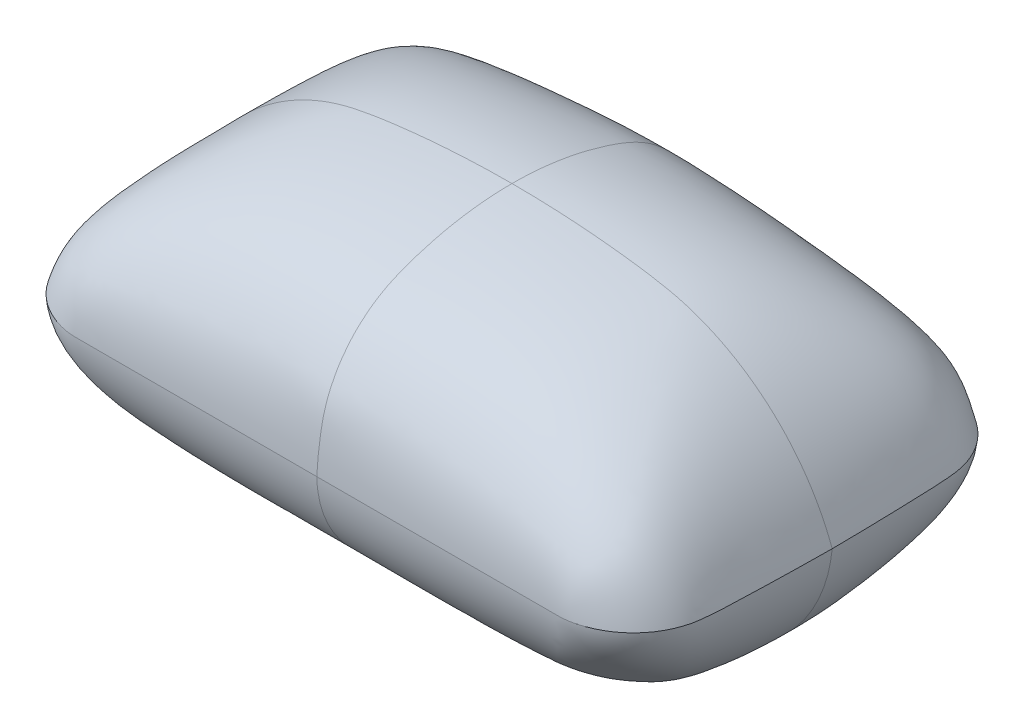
SolidWorks part; units mm, degrees
ref_plane "Front Plane" through (0, 0, 0) normal (0, 0, 1) x (1, 0, 0)
ref_plane "Top Plane" through (0, 0, 0) normal (0, 1, 0) x (1, 0, 0)
ref_plane "Right Plane" through (0, 0, 0) normal (1, 0, 0) x (0, 0, -1)
sketch "Top Layout Sketch" plane through (0, 0, 0) normal (0, 1, 0) x (1, 0, 0)
  line L0 (0, 25) -> (30.5308, 25)
  line L1 (0, -25) -> (30.5308, -25)
  line L3 (-30.5308, 25) -> (0, 25)
  line L5 (0, 25) -> (0, -25) construction
  line L6 (-41, 0) -> (41, 0) construction
  line L7 (0, -25) -> (-30.5308, -25)
  arc A0 (40.5112, 15.625) -> (41, 0) centre (-209, 0) cw
  arc A1 (30.5308, 25) -> (40.5112, 15.625) centre (30.5308, 15) cw
  arc A2 (30.5308, -25) -> (40.5112, -15.625) centre (30.5308, -15) ccw
  arc A6 (41, 0) -> (40.5112, -15.625) centre (-209, 0) cw
  arc A7 (-30.5308, -25) -> (-40.5112, -15.625) centre (-30.5308, -15) cw
  arc A8 (-41, 0) -> (-40.5112, -15.625) centre (209, 0) ccw
  arc A9 (-40.5112, 15.625) -> (-41, 0) centre (209, 0) ccw
  arc A10 (-30.5308, 25) -> (-40.5112, 15.625) centre (-30.5308, 15) ccw
  point P20 (0, 0)
  dimension "D2" = 250
  dimension "D4" = 10
  dimension "D1" = 50
  dimension "D3" = 82
sketch "Front Layout Sketch" plane through (0, 0, 0) normal (0, 0, 1) x (1, 0, 0)
  line L0 (-41, 0) -> (41, 0) construction
  line L1 (-41, 0) -> (41, 0) construction
  line L2 (0, 20) -> (0, -12) construction
  arc A0 (-41, 0) -> (-18.195, 18.6126) centre (-13.7979, -10.0521) cw
  arc A1 (-18.195, 18.6126) -> (0, 20) centre (0, -100) cw
  arc A2 (41, 0) -> (18.195, 18.6126) centre (13.7979, -10.0521) ccw
  arc A3 (18.195, 18.6126) -> (0, 20) centre (0, -100) ccw
  arc A4 (0, -12) -> (-25.5341, -14.7481) centre (0, -132) ccw
  arc A5 (-41, 0) -> (-36.1648, -11.2301) centre (-21.0919, 1.9156) ccw
  arc A6 (-25.5341, -14.7481) -> (-36.1648, -11.2301) centre (-27.8747, -4) cw
  arc A7 (0, -12) -> (25.5341, -14.7481) centre (0, -132) cw
  arc A8 (25.5341, -14.7481) -> (36.1648, -11.2301) centre (27.8747, -4) ccw
  arc A9 (41, 0) -> (36.1648, -11.2301) centre (21.0919, 1.9156) cw
  dimension "D3" = 120
  dimension "D4" = 29
  dimension "D5" = 20
  dimension "D6" = 11
  dimension "D1" = 32
  dimension "D2" = 20
  dimension "D7" = 35
sketch "Side Layout Sketch" plane through (0, 0, 0) normal (1, 0, 0) x (0, 0, -1)
  line L0 (25, 0) -> (-25, 0) construction
  line L1 (25, 0) -> (-25, 0) construction
  line L2 (0, 20) -> (0, -12) construction
  line L3 (0, 20) -> (0, -12) construction
  line L4 (-7.6063, -15) -> (0, -15)
  line L5 (-18.142, -12) -> (18.142, -12) construction
  line L6 (0, -12) -> (0, -15) construction
  line L7 (0, -15) -> (7.6063, -15)
  arc A0 (-25, 0) -> (-24.3441, 5.4) centre (14.9442, -2.112) cw
  arc A1 (-14.3813, 17.3253) -> (0, 20) centre (0, -20) cw
  arc A2 (-24.3441, 5.4) -> (-14.3813, 17.3253) centre (-8.6288, 2.3952) cw
  arc A3 (25, 0) -> (24.3441, 5.4) centre (-14.9442, -2.112) ccw
  arc A4 (24.3441, 5.4) -> (14.3813, 17.3253) centre (8.6288, 2.3952) ccw
  arc A5 (7.6063, -15) -> (18.142, -12) centre (7.6063, 5) ccw
  arc A6 (18.142, -12) -> (25, 0) centre (10.5036, 0.325) ccw
  arc A7 (-7.6063, -15) -> (-18.142, -12) centre (-7.6063, 5) cw
  arc A8 (-18.142, -12) -> (-25, 0) centre (-10.5036, 0.325) cw
  arc A9 (0, 20) -> (14.3813, 17.3253) centre (0, -20) cw
  dimension "D1" = 40
  dimension "D2" = 40
  dimension "D3" = 16
  dimension "D6" = 20
  dimension "D7" = 14.5
  dimension "D4" = 32
  dimension "D5" = 35
sketch "Sketch1" plane through (0, 0, 0) normal (1, 0, 0) x (0, 0, -1)
  line L0 (-25, 0) -> (-25.6336, -11.9833)
  arc A0 (-24.3441, 5.4) -> (-25, 0) centre (14.9442, -2.112) ccw construction
  dimension "D1" = 12
sketch "Sketch2" plane through (0, 0, 0) normal (0, 0, 1) x (1, 0, 0)
  line L0 (41, 0) -> (45.1595, -11.256)
  arc A0 (41, 0) -> (18.195, 18.6126) centre (13.7979, -10.0521) ccw construction
  dimension "D1" = 12
sketch "Sketch3" plane through (0, 0, 0) normal (0, 1, 0) x (1, 0, 0)
  line L0 (0, -25) -> (30.5308, -25) construction
  line L1 (0, -25) -> (30.5308, -25) construction
  arc A0 (40.5112, -15.625) -> (41, 0) centre (-209, 0) ccw construction
  arc A1 (30.5308, -25) -> (40.5112, -15.625) centre (30.5308, -15) ccw construction
  arc A2 (40.5112, -15.625) -> (41, 0) centre (-209, 0) ccw construction
  arc A3 (30.5308, -25) -> (40.5112, -15.625) centre (30.5308, -15) ccw construction
  spline S0 degree 3 poles (0, -25) (10.1769, -25) (20.7703, -25) (31.7802, -25) (33.0319, -24.7092) (33.8255, -24.4508) (34.2127, -24.2975) (36.607, -23.3493) (38.484, -21.5862) (39.58, -19.2558) (39.9403, -18.4896) (40.4664, -16.8657) (40.5973, -14.259) (40.6853, -12.5679) (40.725, -11.7221) (40.9083, -7.8172) (41, -3.9092) (41, 0) knots 0 0 0 0 0.500599 0.521085 0.541572 0.562059 0.562059 0.562059 0.6828 0.6828 0.6828 0.724449 0.766097 0.807746 0.807746 0.807746 1 1 1 1 weights 1 1 1 1 1 1 1 0.953166 0.953166 1 1 1 1 1 1 0.999817 0.999817 1
surface "Surface-Loft1"
sketch "Sketch4" plane through (0, 0, 0) normal (0, 0, 1) x (1, 0, 0)
  arc A0 (18.195, 18.6126) -> (0, 20) centre (0, -100) ccw construction
  arc A1 (41, 0) -> (18.195, 18.6126) centre (13.7979, -10.0521) ccw construction
  arc A2 (18.195, 18.6126) -> (0, 20) centre (0, -100) ccw construction
  arc A3 (41, 0) -> (18.195, 18.6126) centre (13.7979, -10.0521) ccw construction
  spline S0 degree 3 poles (41, 0) (38.251, 7.4391) (32.8265, 13.2247) (25.5797, 16.4467) (24.3381, 16.9987) (21.7774, 17.9283) (17.7138, 18.7087) (15.0193, 19.0641) (13.6694, 19.2189) (9.1303, 19.7394) (4.5689, 20) (0, 20) knots 0 0 0 0 0.465179 0.465179 0.465179 0.549285 0.633391 0.717496 0.717496 0.717496 1 1 1 1 weights 1 0.947574 0.947574 1 1 1 1 1 1 0.998914 0.998914 1
surface "Surface-Extrude1" sketch "Sketch4" parameters "D1"=12
sketch "Sketch5" plane through (0, 0, 0) normal (1, 0, 0) x (0, 0, -1)
  arc A0 (-24.3441, 5.4) -> (-25, 0) centre (14.9442, -2.112) ccw construction
  arc A1 (-14.3813, 17.3253) -> (-24.3441, 5.4) centre (-8.6288, 2.3952) ccw construction
  arc A2 (0, 20) -> (-14.3813, 17.3253) centre (0, -20) ccw construction
  arc A3 (-24.3441, 5.4) -> (-25, 0) centre (14.9442, -2.112) ccw construction
  arc A4 (-14.3813, 17.3253) -> (-24.3441, 5.4) centre (-8.6288, 2.3952) ccw construction
  arc A5 (0, 20) -> (-14.3813, 17.3253) centre (0, -20) ccw construction
  spline S0 degree 3 poles (0, 20) (-3.6894, 20) (-7.3437, 19.4928) (-10.8936, 18.488) (-11.7161, 18.2552) (-13.3462, 17.7369) (-15.7772, 16.7865) (-17.2471, 15.9028) (-17.9422, 15.4052) (-20.9278, 13.2679) (-23.0368, 10.2623) (-24.031, 6.7277) (-24.113, 6.4364) (-24.2603, 5.8491) (-24.43, 4.9552) (-24.5302, 4.3582) (-24.5769, 4.0592) (-24.7869, 2.7139) (-24.9281, 1.3597) (-25, 0) knots 0 0 0 0 0.304682 0.304682 0.304682 0.375724 0.446767 0.517809 0.517809 0.517809 0.81148 0.81148 0.81148 0.836633 0.861786 0.886939 0.886939 0.886939 1 1 1 1 weights 1 0.99367 0.99367 1 1 1 1 1 1 0.962358 0.962358 1 1 1 1 1 1 0.999132 0.999132 1
surface "Surface-Extrude2" sketch "Sketch5" parameters "D1"=12
surface "Surface-Fill1"
sketch "Sketch6" plane through (0, 0, 0) normal (1, 0, 0) x (0, 0, -1)
  line L0 (-18.142, -12) -> (18.142, -12) construction
  line L1 (-15.2654, -12) -> (0, -12) construction
  arc A0 (-25, 0) -> (-18.142, -12) centre (-10.5036, 0.325) ccw construction
  arc A1 (-25, 0) -> (-21.4633, -9.169) centre (-10.5036, 0.325) ccw construction
  arc A2 (-21.4633, -9.169) -> (-15.2654, -12) centre (-15.2654, -3.8) ccw construction
  spline S0 degree 3 poles (-25, 0) (-24.9432, -2.5344) (-24.2384, -4.9695) (-22.9329, -7.1425) (-22.6904, -7.5461) (-22.1662, -8.3296) (-21.2622, -9.4525) (-20.557, -10.0818) (-20.1801, -10.364) (-19.2354, -11.0713) (-18.1619, -11.5616) (-17.0087, -11.8125) (-16.8183, -11.854) (-16.4347, -11.9232) (-15.8499, -12) (-10.3718, -12) (-5.0885, -12) (0, -12) knots 0 0 0 0 0.231073 0.231073 0.231073 0.274969 0.318864 0.36276 0.36276 0.36276 0.471112 0.471112 0.471112 0.489275 0.507437 0.5256 1 1 1 1 weights 1 0.977714 0.977714 1 1 1 1 1 1 0.98476 0.98476 1 1 1 1 1 1 1
  dimension "D1" = 8.2
surface "Surface-Extrude3" sketch "Sketch6" parameters "D1"=12
sketch "Sketch7" plane through (0, 0, 0) normal (0, 0, 1) x (1, 0, 0)
  arc A0 (36.1648, -11.2301) -> (41, 0) centre (21.0919, 1.9156) ccw construction
  arc A1 (25.5341, -14.7481) -> (36.1648, -11.2301) centre (27.8747, -4) ccw construction
  arc A2 (25.5341, -14.7481) -> (0, -12) centre (0, -132) ccw construction
  arc A3 (36.1648, -11.2301) -> (41, 0) centre (21.0919, 1.9156) ccw construction
  arc A4 (25.5341, -14.7481) -> (36.1648, -11.2301) centre (27.8747, -4) ccw construction
  arc A5 (25.5341, -14.7481) -> (0, -12) centre (0, -132) ccw construction
  spline S0 degree 3 poles (0, -12) (7.6122, -12) (15.19, -12.7221) (22.6652, -14.1599) (23.3031, -14.2826) (24.5768, -14.5383) (26.5008, -14.9723) (27.8041, -15.0189) (28.4528, -14.9848) (30.4317, -14.8807) (32.313, -14.2581) (33.9634, -13.1612) (34.5185, -12.7923) (35.5615, -11.9536) (36.8953, -10.3966) (37.6619, -9.3041) (38.0169, -8.7402) (39.6872, -6.0873) (40.6997, -3.1205) (41, 0) knots 0 0 0 0 0.458551 0.458551 0.458551 0.497799 0.537046 0.576294 0.576294 0.576294 0.693198 0.693198 0.693198 0.733465 0.773733 0.814 0.814 0.814 1 1 1 1 weights 1 0.996993 0.996993 1 1 1 1 1 1 0.976377 0.976377 1 1 1 1 1 1 0.981988 0.981988 1
surface "Surface-Extrude4" sketch "Sketch7" parameters "D1"=12
sketch "Sketch8" plane through (0, 0, 0) normal (1, 0, 0) x (0, 0, -1)
  line L0 (-25, 0) -> (-25.269, 11.997)
  arc A0 (-25, 0) -> (-18.142, -12) centre (-10.5036, 0.325) ccw construction
  dimension "D1" = 12
sketch "Sketch9" plane through (0, 0, 0) normal (0, 0, 1) x (1, 0, 0)
  line L0 (41, 0) -> (42.1493, 11.9448)
  arc A0 (36.1648, -11.2301) -> (41, 0) centre (21.0919, 1.9156) ccw construction
  dimension "D1" = 12
surface "Surface-Loft2"
sketch "Sketch10" plane through (0, 0, 0) normal (1, 0, 0) x (0, 0, -1)
  spline S0 degree 3 poles (-25, 0) (-24.9432, -2.5344) (-24.2384, -4.9695) (-22.9329, -7.1425) (-22.6904, -7.5461) (-22.1662, -8.3296) (-21.2622, -9.4525) (-20.557, -10.0818) (-20.1801, -10.364) (-19.2354, -11.0713) (-18.1619, -11.5616) (-17.0087, -11.8125) (-16.8183, -11.854) (-16.4347, -11.9232) (-15.8499, -12) (-10.3718, -12) (-5.0885, -12) (0, -12) knots 0 0 0 0 0.231073 0.231073 0.231073 0.274969 0.318864 0.36276 0.36276 0.36276 0.471112 0.471112 0.471112 0.489275 0.507437 0.5256 1 1 1 1 weights 1 0.977714 0.977714 1 1 1 1 1 1 0.98476 0.98476 1 1 1 1 1 1 1 construction
  spline S1 degree 3 poles (-20.2824, -10.2861) (-20.2485, -10.3123) (-20.2144, -10.3383) (-20.1801, -10.364) (-19.2354, -11.0713) (-18.1619, -11.5616) (-17.0087, -11.8125) (-16.8183, -11.854) (-16.4347, -11.9232) (-15.8499, -12) (-10.3718, -12) (-5.0885, -12) (0, -12) knots 0.358764 0.358764 0.358764 0.358764 0.36276 0.36276 0.36276 0.471112 0.471112 0.471112 0.489275 0.507437 0.5256 1 1 1 1 weights 1 1 1 1 0.98476 0.98476 1 1 1 1 1 1 1
sketch "Sketch11" plane through (0, 0, 0) normal (0, 0, 1) x (1, 0, 0)
  spline S0 degree 3 poles (-104.6179, -190.7801) (-140.2017, -127.4474) (-141.0521, 17.3292) (22.6652, -14.1599) (23.3031, -14.2826) (24.5768, -14.5383) (26.5008, -14.9723) (27.8041, -15.0189) (28.4528, -14.9848) (30.4317, -14.8807) (32.313, -14.2581) (33.9634, -13.1612) (34.5185, -12.7923) (35.5615, -11.9536) (36.8953, -10.3966) (37.6619, -9.3041) (38.0169, -8.7402) (236.1659, 305.9889) (6.504, 16.3366) (4.1, 12.4643) knots -8.990592 -8.990592 -8.990592 -8.990592 0.458551 0.458551 0.458551 0.497799 0.537046 0.576294 0.576294 0.576294 0.693198 0.693198 0.693198 0.733465 0.773733 0.814 0.814 0.814 7.88915 7.88915 7.88915 7.88915 weights 4.644247 2.152793 0.938044 1 1 1 1 1 1 0.976377 0.976377 1 1 1 1 1 1 0.314855 25.691607 77.130255 only from (0, -12) to (41, 0) construction
  spline S1 degree 3 poles (0, -12) (7.6122, -12) (15.19, -12.7221) (22.6652, -14.1599) (23.3031, -14.2826) (24.5768, -14.5383) (26.5008, -14.9723) (27.8041, -15.0189) (28.4528, -14.9848) (28.9209, -14.9602) (29.3874, -14.9057) (29.8505, -14.8211) knots 0 0 0 0 0.458551 0.458551 0.458551 0.497799 0.537046 0.576294 0.576294 0.576294 0.604451 0.604451 0.604451 0.604451 weights 1 0.996993 0.996993 1 1 1 1 1 1 0.99431 0.989991 0.987042
surface "Surface-Sweep1"
sketch "Sketch12" plane through (0, 0, 0) normal (0, 1, 0) x (1, 0, 0)
  line L0 (0, -15.2654) -> (-12, -15.2654)
  line L1 (-12, 0) -> (-12, -25) construction
  line L2 (27.8747, 0) -> (27.8747, 12)
  line L3 (41, 12) -> (0, 12) construction
  spline S0 degree 3 poles (27.8747, 0) (27.8747, -15.0433) (15.1184, -15.2654) (0, -15.2654) knots 0 0 0 0 1 1 1 1
other "DeleteFace1"
surface "Surface-Loft3"
surface "Surface-Knit1"
other "Intersect1"
mirror "Mirror1" about plane through (0, 0, 0) normal (1, 0, 0)
mirror "Mirror2" about plane through (0, 0, 0) normal (0, 0, 1)
